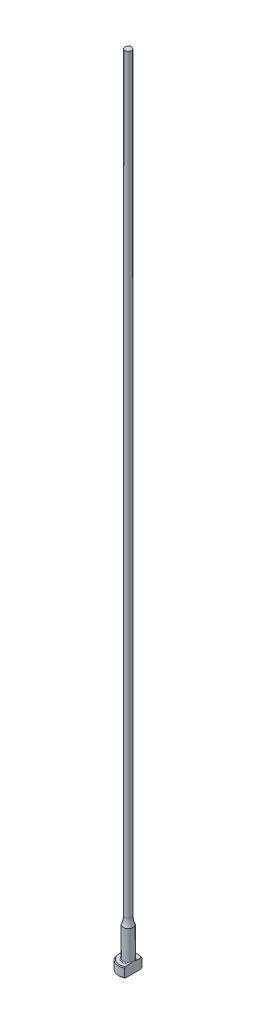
SolidWorks part; units mm, degrees
ref_plane "Front Plane" through (0, 0, 0) normal (0, 0, 1) x (1, 0, 0)
ref_plane "Top Plane" through (0, 0, 0) normal (0, 1, 0) x (1, 0, 0)
ref_plane "Right Plane" through (0, 0, 0) normal (1, 0, 0) x (0, 0, -1)
sketch "Sketch1" plane through (0, 0, 0) normal (0, 0, 1) x (1, 0, 0)
  line L0 (0, 259.9588) -> (0, -15.1925) construction
  line L1 (0, 0) -> (-3.175, 0)
  line L2 (-3.175, 0) -> (-3.175, 3.175)
  line L3 (-3.175, 3.175) -> (-1.5875, 3.175)
  line L4 (-1.0554, 15.2446) -> (-1.0554, 254)
  line L5 (-1.0554, 254) -> (0, 254)
  line L6 (0, 254) -> (0, 0)
  line L7 (-1.5875, 3.175) -> (-1.5875, 12.7)
  arc A0 (-1.5875, 12.7) -> (-1.0554, 15.2446) centre (-7.4054, 15.2446) ccw
  point P13 (-1.5875, 0)
  dimension "D1" = 6.35
  dimension "L" = 254
  dimension "D2" = 3.175
  dimension "H" = 6.35
  dimension "T" = 3.175
  dimension "D" = 2.1107
  dimension "S" = 12.7
revolve "Revolve1" add sketch "Sketch1" angle 360 about L0
chamfer "Chamfer1" distance 0.254 angle 45 2 edges at (0, 3.175, 3.175) (0, 0, 3.175)
fillet "Fillet1" radius 0.254 1 edges at (0, 3.175, 1.5875)
sketch "Sketch2" plane through (0, 0, 0) normal (0, 1, 0) x (1, 0, 0)
  line L0 (1.5875, -2.7496) -> (1.5875, 2.7496)
  circle A0 centre (0, 0) radius 3.175 construction
  arc A2 (1.5875, -2.7496) -> (1.5875, 2.7496) centre (0, 0) ccw
  circle A3 centre (0, 0) radius 3.175 construction
  circle A4 centre (0, 0) radius 1.5875 construction
extrude "Key Head" cut sketch "Sketch2" along normal up to next
